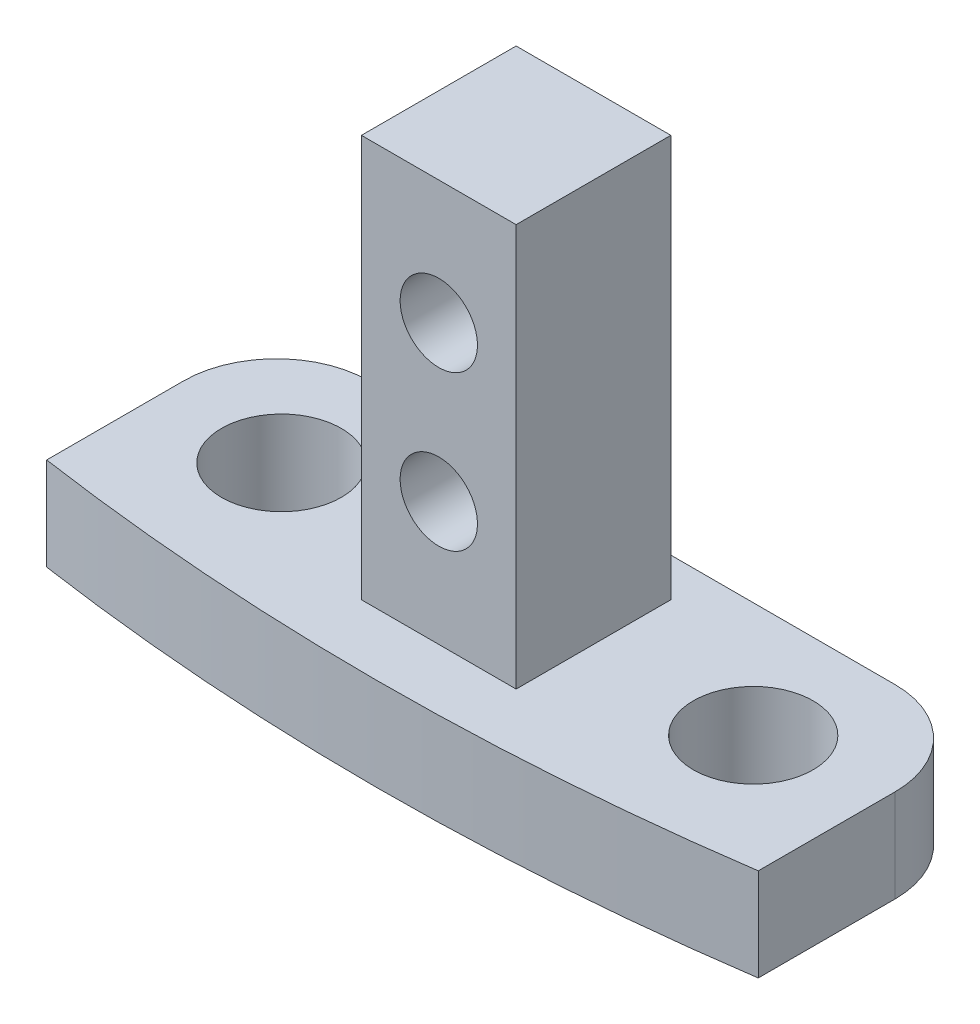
SolidWorks part; units mm, degrees
ref_plane "Front Plane" through (0, 0, 0) normal (0, 0, 1) x (1, 0, 0)
ref_plane "Top Plane" through (0, 0, 0) normal (0, 1, 0) x (1, 0, 0)
ref_plane "Right Plane" through (0, 0, 0) normal (1, 0, 0) x (0, 0, -1)
sketch "Sketch1" plane through (0, 0, 0) normal (0, 1, 0) x (1, 0, 0)
  line L0 (0, 79.1345) -> (-14.605, -20.7814) construction
  line L1 (0, 79.1345) -> (14.605, -20.7814) construction
  line L2 (0, 79.1345) -> (0, -21.8432) construction
  line L3 (-14.605, -20.7814) -> (-14.605, -11.353)
  line L4 (-14.605, -11.353) -> (14.605, -11.353)
  line L5 (14.605, -11.353) -> (14.605, -20.7814)
  line L6 (4.7625, -11.353) -> (-4.7625, -11.353) construction
  arc A0 (14.605, -20.7814) -> (-14.605, -20.7814) centre (0, 79.1345) cw
  circle A1 centre (0, 79.1345) radius 101.2317 construction
  dimension "D1" = 0.254
  dimension "D2" = 29.21
extrude "Boss-Extrude1" add sketch "Sketch1" along normal blind 3.81
sketch "Sketch2" plane through (0, 3.81, 0) normal (0, 1, 0) x (1, 0, 0)
  line L0 (14.605, -11.353) -> (-14.605, -11.353) construction
  line L1 (-3.175, -19.2905) -> (3.175, -19.2905)
  line L2 (-3.175, -19.2905) -> (-3.175, -12.9405)
  line L3 (-3.175, -12.9405) -> (3.175, -12.9405)
  line L4 (3.175, -19.2905) -> (3.175, -12.9405)
  line L5 (-3.175, -19.2905) -> (3.175, -12.9405) construction
  line L6 (-3.175, -12.9405) -> (3.175, -19.2905) construction
  point P0 (0, -16.1155)
  dimension "D1" = 6.35
  dimension "D2" = 6.35
  dimension "D3" = 1.5875
extrude "Boss-Extrude2" add sketch "Sketch2" along normal blind 16.51
hole_wizard "#10 (0.1935) Diameter Hole1" positions "Sketch4" profile "Sketch3" hole size "#10" standard "ANSI Inch"
sketch "Sketch4" plane through (0, 3.81, 0) normal (0, 1, 0) x (1, 0, 0)
  line L2 (0, -11.353) -> (0, -21.8432) construction
  line L3 (14.605, -11.353) -> (-14.605, -11.353) construction
  line L4 (4.7625, -16.0672) -> (14.605, -16.0672) construction
  line L5 (14.605, -20.7814) -> (14.605, -11.353) construction
  line L6 (3.175, -19.2905) -> (3.175, -12.9405) construction
  arc A0 (-14.605, -20.7814) -> (14.605, -20.7814) centre (0, 79.1345) ccw construction
  point P0 (9.6838, -16.0672)
  point P2 (-9.6838, -16.0672)
  dimension "D1" = 1.5875
sketch "Sketch3" plane through (9.6838, 3.81, 16.0672) normal (1, 0, 0) x (0, 0, 1)
  line L0 (0, 0) -> (0, 3.81)
  line L1 (0, 3.81) -> (2.4574, 3.81)
  line L2 (2.4574, 3.81) -> (2.4574, 0)
  line L5 (2.4574, 0) -> (0, 0)
  line L11 (0, -6.35) -> (0, 107.95) construction
  dimension "Thru Hole Dia." = 4.9149
  dimension "Thru Hole Depth" = 3.81
hole_wizard "1/8 (0.125) Diameter Hole1" positions "Sketch6" profile "Sketch5" hole size "1/8" standard "ANSI Inch"
sketch "Sketch6" plane through (0, 0, 12.9405) normal (0, 0, -1) x (-1, 0, 0)
  line L4 (0, 15.24) -> (0, 8.89) construction
  line L5 (-3.175, 12.065) -> (0, 12.065) construction
  line L6 (-3.175, 20.32) -> (-3.175, 3.81) construction
  point P0 (0, 15.24)
  point P2 (0, 8.89)
  dimension "D1" = 6.35
sketch "Sketch5" plane through (0, 15.24, 12.9405) normal (1, 0, 0) x (0, 1, 0)
  line L0 (0, 0) -> (0, 8.9027)
  line L1 (0, 8.9027) -> (1.5875, 8.9027)
  line L2 (1.5875, 8.9027) -> (1.5875, 0)
  line L5 (1.5875, 0) -> (0, 0)
  line L11 (0, -6.35) -> (0, 107.95) construction
  dimension "Thru Hole Dia." = 3.175
  dimension "Thru Hole Depth" = 8.9027
fillet "Fillet1" radius 3.81 2 edges at (-14.605, 1.905, 11.353) (14.605, 1.905, 11.353)
